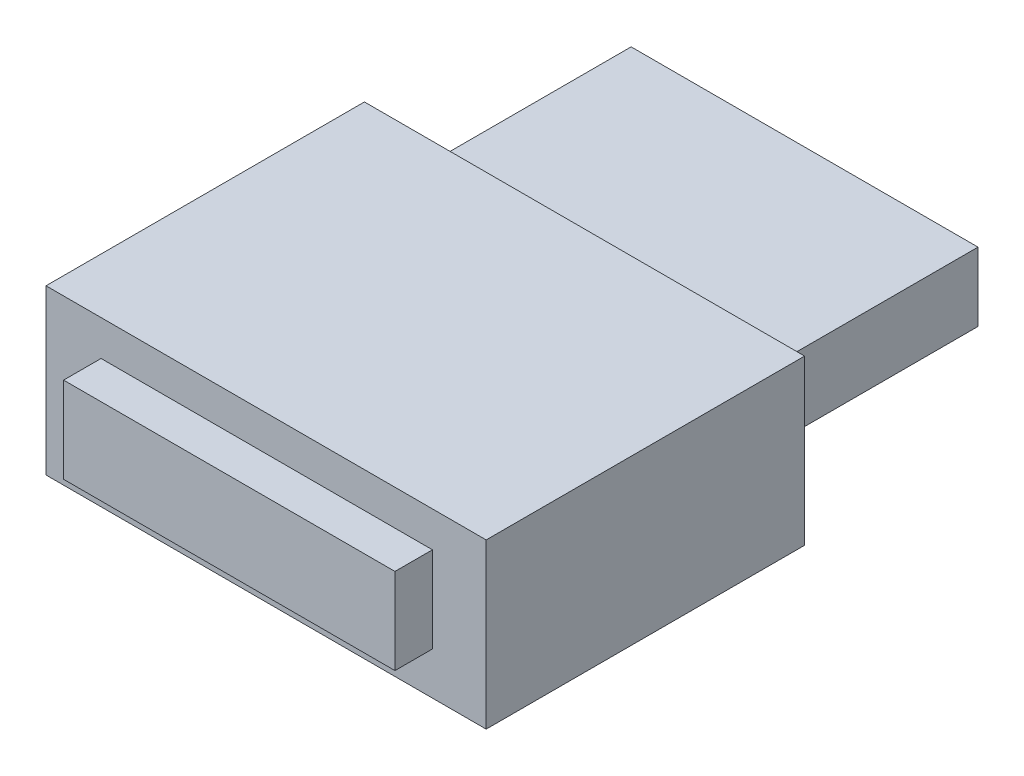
SolidWorks part; units mm, degrees
ref_plane "Front Plane" through (0, 0, 0) normal (0, 0, 1) x (1, 0, 0)
ref_plane "Top Plane" through (0, 0, 0) normal (0, 1, 0) x (1, 0, 0)
ref_plane "Right Plane" through (0, 0, 0) normal (1, 0, 0) x (0, 0, -1)
sketch "Sketch1" plane through (0, 0, 0) normal (0, 1, 0) x (1, 0, 0)
  line L1 (-71.6746, 29.6602) -> (23.8294, 29.6602)
  line L2 (-71.6746, 29.6602) -> (-71.6746, -39.4278)
  line L3 (-71.6746, -39.4278) -> (23.8294, -39.4278)
  line L4 (23.8294, 29.6602) -> (23.8294, -39.4278)
  dimension "D1" = 95.504
  dimension "D2" = 69.088
extrude "Extrude1" add sketch "Sketch1" along normal blind 35.56
sketch "Sketch2" plane through (0, 0, 39.4278) normal (0, 0, 1) x (1, 0, 0)
  line L1 (-59.7292, 27.8716) -> (12.1661, 27.8716)
  line L2 (-59.7292, 27.8716) -> (-59.7292, 9.2338)
  line L3 (-59.7292, 9.2338) -> (12.1661, 9.2338)
  line L4 (12.1661, 27.8716) -> (12.1661, 9.2338)
extrude "Extrude2" add sketch "Sketch2" along normal blind 8.128
sketch "Sketch3" plane through (0, 0, -29.6602) normal (0, 0, -1) x (-1, 0, 0)
  line L1 (64.608, 24.0443) -> (-10.6523, 24.0443)
  line L2 (64.608, 24.0443) -> (64.608, 9.1325)
  line L3 (64.608, 9.1325) -> (-10.6523, 9.1325)
  line L4 (-10.6523, 24.0443) -> (-10.6523, 9.1325)
extrude "Extrude3" add sketch "Sketch3" along normal blind 50.8
